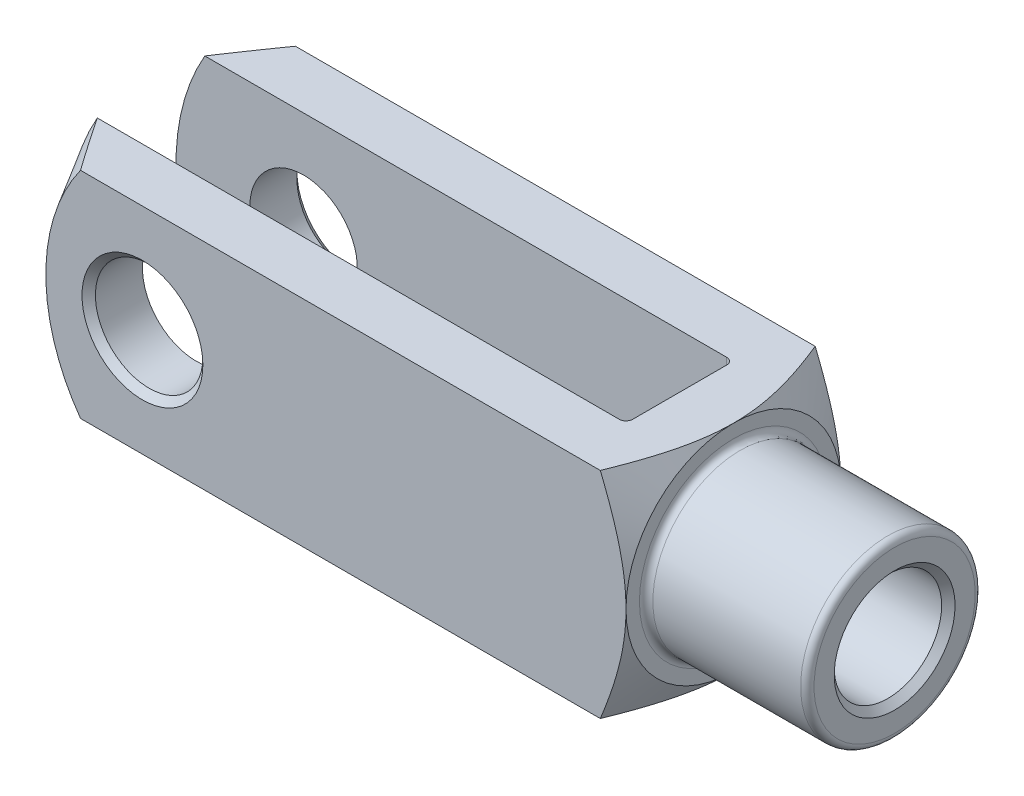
SolidWorks part; units mm, degrees
ref_plane "Front Plane" through (0, 0, 0) normal (0, 0, 1) x (1, 0, 0)
ref_plane "Top Plane" through (0, 0, 0) normal (0, 1, 0) x (1, 0, 0)
ref_plane "Right Plane" through (0, 0, 0) normal (1, 0, 0) x (0, 0, -1)
sketch "Sketch1" plane through (0, 0, 0) normal (1, 0, 0) x (0, 0, -1)
  line L0 (0, 0) -> (0, 50000) construction
  line L1 (0, 0) -> (50000, 0) construction
  line L2 (-16, -16) -> (-16, 16)
  line L3 (-16, 16) -> (16, 16)
  line L4 (16, -16) -> (16, 16)
  line L5 (-16, -16) -> (16, -16)
  point P9 (0, 16)
  point P11 (16, 0)
  point P12 (-16, 0)
  dimension "D1" = 32
  dimension "D2" = 32
extrude "Extrude1" add sketch "Sketch1" against normal blind 115
sketch "Sketch2" plane through (0, 0, 0) normal (1, 0, 0) x (0, 0, -1)
  circle A0 centre (0, 0) radius 13
  circle A1 centre (0, 0) radius 26
  dimension "D1" = 26
  dimension "D2" = 52
extrude "Extrude2" cut sketch "Sketch2" against normal blind 24
sketch "Sketch3" plane through (0, 0, 16) normal (0, 0, 1) x (1, 0, 0)
  circle A0 centre (-96, 0) radius 8
  dimension "D1" = 16
  dimension "D2" = 96
extrude "Extrude3" cut sketch "Sketch3" against normal through all
sketch "Sketch4" plane through (0, 16, 0) normal (0, 1, 0) x (1, 0, 0)
  line L0 (0, 0) -> (-50000, 0) construction
  line L1 (-115, -8) -> (-115, 8)
  line L2 (-115, 16) -> (-115, -16) construction
  line L3 (-115, 8) -> (-32, 8)
  line L4 (-32, 8) -> (-32, -8)
  line L5 (-96, 16) -> (-96, -16) construction
  line L6 (-115, -8) -> (-32, -8)
  point P7 (-96, 0)
  point P13 (-32, 0)
  point P14 (-115, 0)
  dimension "D1" = 64
  dimension "D2" = 16
extrude "Extrude4" cut sketch "Sketch4" against normal through all
fillet "Fillet1" radius 1 2 edges at (-32, 0, 8) (-32, 0, -8)
fillet "Fillet2" radius 1 2 edges at (0, 0, -13) (-24, 0, -13)
chamfer "Chamfer2" distance 1 angle 45 2 edges at (-88, 0, -16) (-88, 0, 16)
sketch "Sketch6" plane through (0, 0, 0) normal (0, 0, 1) x (1, 0, 0)
  line L0 (-24, -16) -> (-24, -32)
  line L1 (-24, -32) -> (-33.2376, -32)
  line L2 (-33.2376, -32) -> (-24, -16)
  dimension "D1" = 30
  dimension "D2" = 32
revolve "Cut-Revolve1" cut sketch "Sketch6" angle 360 about axis through (-24, 0, 0) along (1, 0, 0)
sketch "Sketch7" plane through (0, 0, 0) normal (0, 1, 0) x (1, 0, 0)
  line L0 (-110.3812, -16) -> (-115, -8)
  line L1 (-115, 8) -> (-110.3812, 16)
  line L2 (-110.3812, 16) -> (-147, 16)
  line L3 (-115, 8) -> (-115, -8)
  line L4 (-147, 16) -> (-147, -16)
  line L5 (-147, -16) -> (-110.3812, -16)
  line L6 (-115, 16) -> (-27.8263, 16) construction
  line L7 (-115, -16) -> (-27.8263, -16) construction
  line L8 (-83, 0.6162) -> (-83, 50000.6162) construction
  dimension "D1" = 120
  dimension "D2" = 32
  dimension "D3" = 32
revolve "Cut-Revolve2" cut sketch "Sketch7" angle 180 about L8
sketch "Sketch8" plane through (0, 0, 0) normal (1, 0, 0) x (0, 0, -1)
  circle A0 centre (0, 0) radius 8
  dimension "D1" = 16
extrude "Extrude5" cut sketch "Sketch8" against normal through all
chamfer "Chamfer3" distance 1 angle 45 1 edges at (0, 0, -8)
equation "\"D2@Sketch1\" = \"D1@Sketch1\""
equation "\"D2@Sketch2\" = \"D1@Sketch2\"*2"
equation "\"D2@Sketch6\" = \"D1@Sketch1\""
equation "\"D2@Sketch7\" = \"D1@Sketch1\""
equation "\"D3@Sketch7\" = \"D1@Sketch1\""
